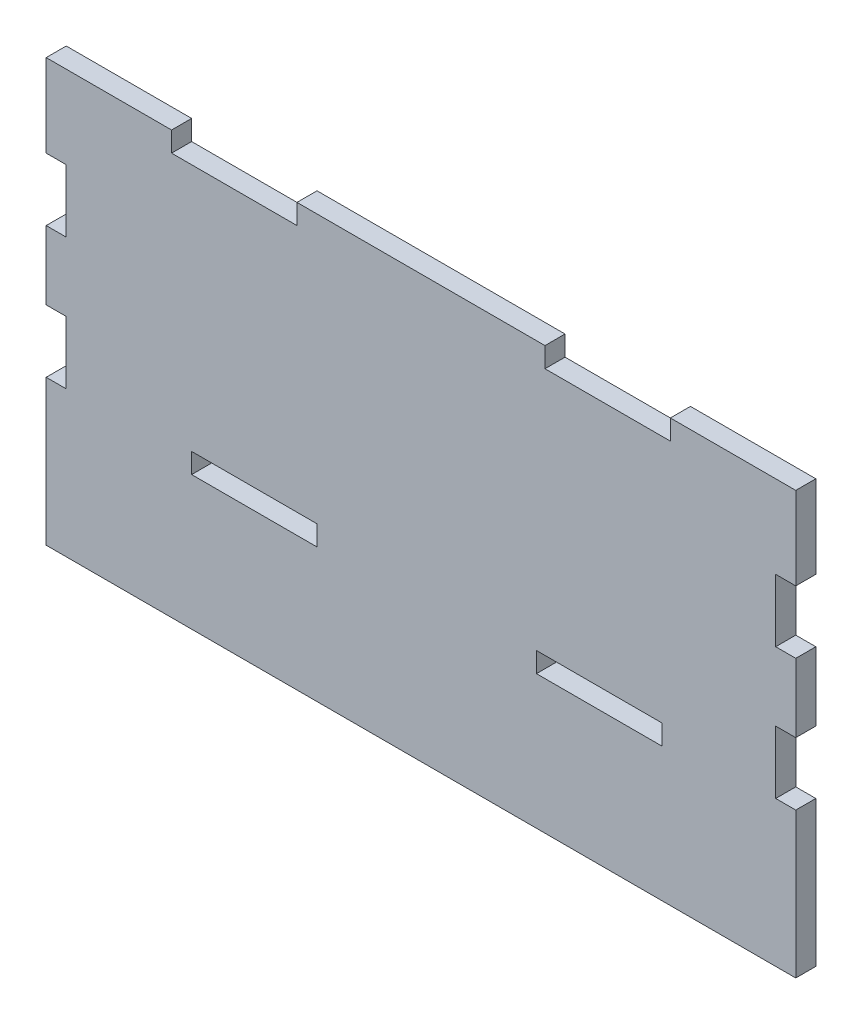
SolidWorks part; units mm, degrees
ref_plane "Front Plane" through (0, 0, 0) normal (0, 0, 1) x (1, 0, 0)
ref_plane "Top Plane" through (0, 0, 0) normal (0, 1, 0) x (1, 0, 0)
ref_plane "Right Plane" through (0, 0, 0) normal (1, 0, 0) x (0, 0, -1)
sketch "Sketch1" plane through (0, 0, 0) normal (0, 0, 1) x (1, 0, 0)
  line L0 (-16, 320.8) -> (-16, 254.8)
  line L1 (581.8, -16) -> (-16, -16)
  line L2 (-16, 204.8) -> (-16, 150)
  line L3 (170, 320.8) -> (581.8, 320.8)
  line L5 (170, 320.8) -> (-16, 320.8)
  line L6 (381.8, 320.8) -> (381.8, 304.8)
  line L7 (581.8, 204.8) -> (581.8, 150)
  line L8 (84, 320.8) -> (184, 320.8)
  line L9 (84, 320.8) -> (84, 304.8)
  line L10 (84, 304.8) -> (184, 304.8)
  line L11 (581.8, 254.8) -> (565.8, 254.8)
  line L12 (581.8, 254.8) -> (581.8, 204.8)
  line L13 (184, 320.8) -> (184, 304.8)
  line L14 (481.8, 304.8) -> (381.8, 304.8)
  line L15 (481.8, 320.8) -> (481.8, 304.8)
  line L16 (581.8, 204.8) -> (565.8, 204.8)
  line L17 (481.8, 320.8) -> (381.8, 320.8)
  line L20 (0, 150) -> (0, 100)
  line L22 (565.8, 254.8) -> (565.8, 204.8)
  line L23 (565.8, 100) -> (581.8, 100)
  line L24 (581.8, 150) -> (565.8, 150)
  line L25 (581.8, 100) -> (581.8, -16)
  line L26 (-16, 150) -> (-16, 100)
  line L27 (-16, 100) -> (-16, -16)
  line L28 (-16, 150) -> (0, 150)
  line L29 (0, 100) -> (-16, 100)
  line L30 (581.8, 150) -> (581.8, 100)
  line L31 (565.8, 150) -> (565.8, 100)
  line L33 (0, 254.8) -> (0, 204.8)
  line L34 (-16, 204.8) -> (0, 204.8)
  line L35 (-16, 254.8) -> (-16, 204.8)
  line L36 (-16, 254.8) -> (0, 254.8)
  line L37 (581.8, 320.8) -> (581.8, 254.8)
  line L46 (200, 90.8) -> (200, 106.8)
  line L47 (475, 90.8) -> (375, 90.8)
  line L48 (475, 90.8) -> (475, 106.8)
  line L49 (475, 106.8) -> (375, 106.8)
  line L50 (375, 90.8) -> (375, 106.8)
  line L51 (100, 106.8) -> (200, 106.8)
  line L52 (100, 90.8) -> (100, 106.8)
  line L53 (100, 90.8) -> (200, 90.8)
  point P1 (573.8, 254.8)
extrude "Boss-Extrude1" add sketch "Sketch1" along normal blind 16
equation "\"thk\"= 16mm"
equation "\"D1@Boss-Extrude1\"=\"thk\""
equation "\"D2@Sketch1\"=\"thk\""
equation "\"D5@Sketch1\"=\"thk\""
equation "\"D6@Sketch1\"=\"thk\""
equation "\"D7@Sketch1\"=\"thk\""
equation "\"D10@Sketch1\"=\"thk\""
equation "\"D12@Sketch1\"=\"thk\""
equation "\"D13@Sketch1\"=\"thk\""
equation "\"D4@Sketch1\"=\"thk\""
